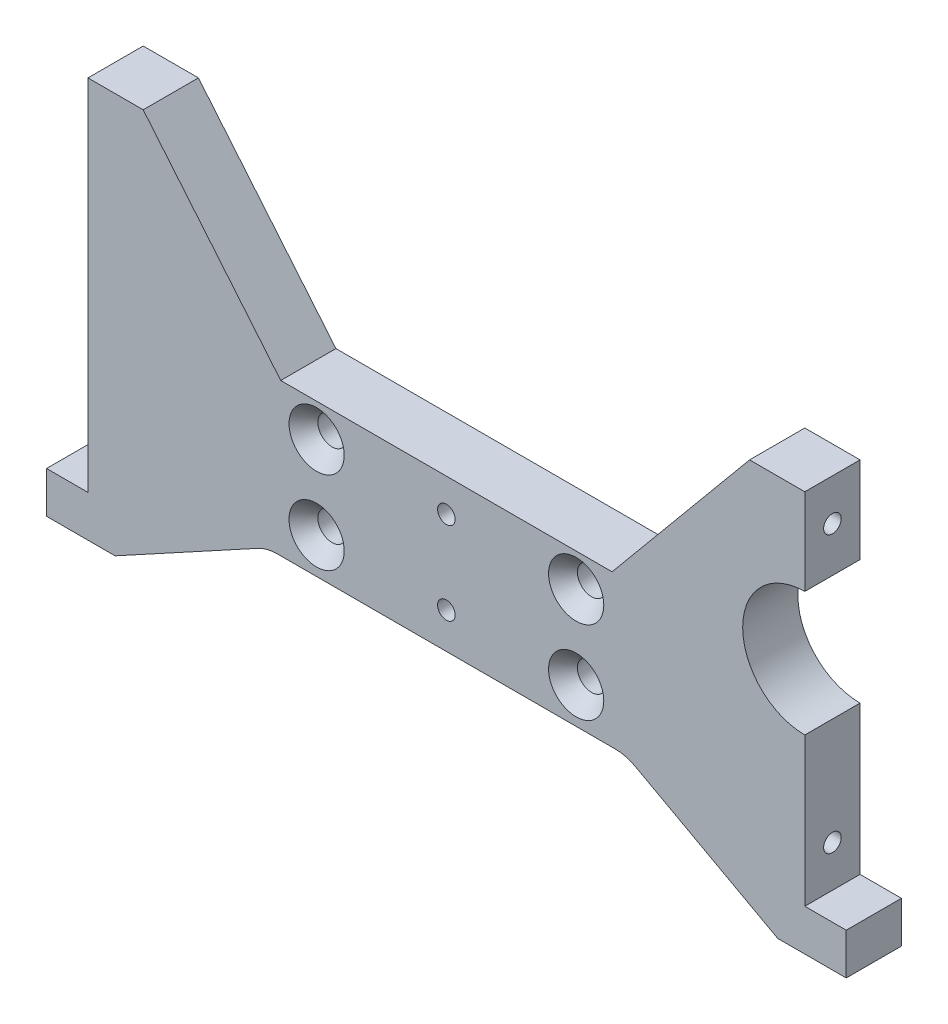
SolidWorks part; units mm, degrees
ref_plane "Front Plane" through (0, 0, 0) normal (0, 0, 1) x (1, 0, 0)
ref_plane "Top Plane" through (0, 0, 0) normal (0, 1, 0) x (1, 0, 0)
ref_plane "Right Plane" through (0, 0, 0) normal (1, 0, 0) x (0, 0, -1)
sketch "Sketch2" plane through (0, 0, 0) normal (0, 0, 1) x (1, 0, 0)
  line L0 (0, 0) -> (0, 82.55) construction
  line L1 (0, 0) -> (82.423, 0) construction
  line L2 (-82.423, 19.8374) -> (-82.423, 0)
  line L3 (-91.948, -9.525) -> (91.948, -9.525)
  line L4 (91.948, -9.525) -> (91.948, 0)
  line L5 (82.423, 82.55) -> (-82.423, 82.55)
  line L6 (-91.948, -9.525) -> (-91.948, 0)
  line L7 (82.423, 34.1122) -> (82.423, 0)
  line L9 (82.423, 82.55) -> (82.423, 62.6872)
  line L10 (82.423, 0) -> (91.948, 0)
  line L11 (-82.423, 0) -> (-91.948, 0)
  line L12 (-82.423, 82.55) -> (-82.423, 19.8374)
  arc A1 (82.423, 62.6872) -> (82.423, 34.1122) centre (82.423, 48.3997) ccw
  dimension "D7" = 28.575
  dimension "D1" = 82.55
  dimension "D2" = 164.846
  dimension "D3" = 19.8628
  dimension "D5" = 9.525
  dimension "D6" = 183.896
extrude "Boss-Extrude1" add sketch "Sketch2" against normal blind 12.7
sketch "Sketch14" plane through (0, 0, 0) normal (0, 0, 1) x (1, 0, 0)
  line L0 (-69.723, 82.55) -> (-38.1, 44.45)
  line L1 (82.423, 82.55) -> (-82.423, 82.55) construction
  line L2 (-38.1, 44.45) -> (38.1, 44.45)
  line L3 (38.1, 44.45) -> (69.723, 82.55)
  line L4 (0, 44.45) -> (0, 0) construction
  line L5 (-69.723, 82.55) -> (69.723, 82.55)
  line L6 (82.423, 62.6872) -> (82.423, 82.55) construction
  dimension "D1" = 38.1
  dimension "D2" = 76.2
  dimension "D3" = 12.7
extrude "Cut-Extrude1" cut sketch "Sketch14" against normal through all
hole_wizard "F (0.257) Diameter Hole2" positions "Sketch7" profile "Sketch6" hole size "F" standard "Ansi Inch"
sketch "Sketch7" plane through (0, 0, 0) normal (0, 0, 1) x (1, 0, 0)
  line L0 (0, 0) -> (0, 44.45) construction
  line L3 (0, 27.305) -> (-41.2819, 27.305) construction
  line L4 (-38.1, 44.45) -> (38.1, 44.45) construction
  point P0 (-29.845, 36.83)
  point P13 (-29.845, 17.78)
  point P15 (29.845, 17.78)
  point P16 (29.845, 36.83)
  dimension "D1" = 7.62
  dimension "D2" = 19.05
  dimension "D3" = 59.69
sketch "Sketch6" plane through (-29.845, 36.83, 0) normal (1, 0, 0) x (0, -1, 0)
  line L0 (0, 0) -> (0, 12.7)
  line L1 (0, 12.7) -> (3.2639, 12.7)
  line L2 (3.2639, 12.7) -> (3.2639, 3.5502)
  line L3 (3.2639, 3.5502) -> (6.35, 0)
  line L5 (6.35, 0) -> (0, 0)
  line L6 (-3.2639, 3.5502) -> (-6.35, 0) construction
  line L11 (0, -6.35) -> (0, 107.95) construction
  dimension "Thru Hole Dia." = 6.5278
  dimension "Thru Hole Depth" = 12.7
  dimension "Near C'Sink Dia." = 12.7
  dimension "Near C'Sink Angle" = 82
hole_wizard "#10-32 Tapped Hole3" positions "Sketch9" profile "Sketch8" tap size "#10-32" standard "Ansi Inch"
sketch "Sketch9" plane through (0, 0, 0) normal (0, 0, 1) x (1, 0, 0)
  line L0 (0, 44.45) -> (0, 8.0181) construction
  line L2 (-38.1, 44.45) -> (38.1, 44.45) construction
  point P0 (0, 36.83)
  point P9 (0, 17.78)
  point P11 (0, -1.27)
  dimension "D1" = 7.62
  dimension "D2" = 19.05
  dimension "D3" = 19.05
sketch "Sketch8" plane through (0, 36.83, 0) normal (1, 0, 0) x (0, -1, 0)
  line L0 (0, 0) -> (0, 12.7)
  line L1 (0, 12.7) -> (2.0193, 12.7)
  line L2 (2.0193, 12.7) -> (2.0193, 0)
  line L5 (2.0193, 0) -> (0, 0)
  line L11 (0, -6.35) -> (0, 107.95) construction
  dimension "Thru Tap Drill Dia." = 4.0386
  dimension "Thru Tap Drill Depth" = 12.7
hole_wizard "#10-32 Tapped Hole1" positions "Sketch11" profile "Sketch10" tap size "#10-32" standard "Ansi Inch"
sketch "Sketch11" plane through (82.423, 0, 0) normal (1, 0, 0) x (0, 0, -1)
  line L0 (12.7, 82.55) -> (0, 82.55) construction
  line L1 (12.7, 0) -> (0, 0) construction
  point P0 (6.35, 73.025)
  point P4 (6.35, 9.525)
  dimension "D1" = 6.35
  dimension "D2" = 9.525
  dimension "D3" = 9.525
  dimension "D4" = 63.5
sketch "Sketch10" plane through (82.423, 73.025, -6.35) normal (0, 1, 0) x (0, 0, -1)
  line L0 (0, 0) -> (0, 13.2529)
  line L1 (0, 13.2529) -> (2.0193, 12.0396)
  line L2 (2.0193, 12.0396) -> (2.0193, 0)
  line L5 (2.0193, 0) -> (0, 0)
  line L10 (0, 13.2529) -> (-2.0193, 12.0396) construction
  line L11 (0, -6.35) -> (0, 107.95) construction
  dimension "Tap Drill Dia." = 4.0386
  dimension "Tap Drill Depth" = 12.0396
  dimension "Drill Angle" = 118
hole_wizard "#10-32 Tapped Hole2" positions "Sketch13" profile "Sketch12" tap size "#10-32" standard "Ansi Inch"
sketch "Sketch13" plane through (-82.423, 0, 0) normal (-1, 0, 0) x (0, 0, 1)
  line L0 (-12.7, 0) -> (0, 0) construction
  line L1 (-12.7, 82.55) -> (0, 82.55) construction
  point P0 (-6.35, 9.525)
  point P4 (-6.35, 73.025)
  dimension "D1" = 6.35
  dimension "D2" = 9.525
  dimension "D3" = 9.525
sketch "Sketch12" plane through (-82.423, 9.525, -6.35) normal (0, 1, 0) x (0, 0, 1)
  line L0 (0, 0) -> (0, 13.2529)
  line L1 (0, 13.2529) -> (2.0193, 12.0396)
  line L2 (2.0193, 12.0396) -> (2.0193, 0)
  line L5 (2.0193, 0) -> (0, 0)
  line L10 (0, 13.2529) -> (-2.0193, 12.0396) construction
  line L11 (0, -6.35) -> (0, 107.95) construction
  dimension "Tap Drill Dia." = 4.0386
  dimension "Tap Drill Depth" = 12.0396
  dimension "Drill Angle" = 118
sketch "Sketch15" plane through (0, 0, -12.7) normal (0, 0, -1) x (-1, 0, 0)
  line L0 (-41.275, 9.525) -> (41.275, 9.525)
  line L1 (0, 9.525) -> (0, 0) construction
  line L2 (41.275, 9.525) -> (76.2, -9.525)
  line L3 (91.948, -9.525) -> (-91.948, -9.525) construction
  line L4 (-41.275, 9.525) -> (-76.2, -9.525)
  line L5 (-76.2, -9.525) -> (76.2, -9.525)
  dimension "D1" = 151.39
  dimension "D2" = 19.05
  dimension "D3" = 82.55
  dimension "D4" = 152.4
extrude "Rev.A" cut sketch "Sketch15" against normal through all
fillet "Fillet1" radius 9.525 2 edges at (41.275, 9.525, -6.35) (-41.275, 9.525, -6.35)
equation "\"Buoyancy\"=\"SW-Volume\"*(\"SW-Density\"-.037062)"
